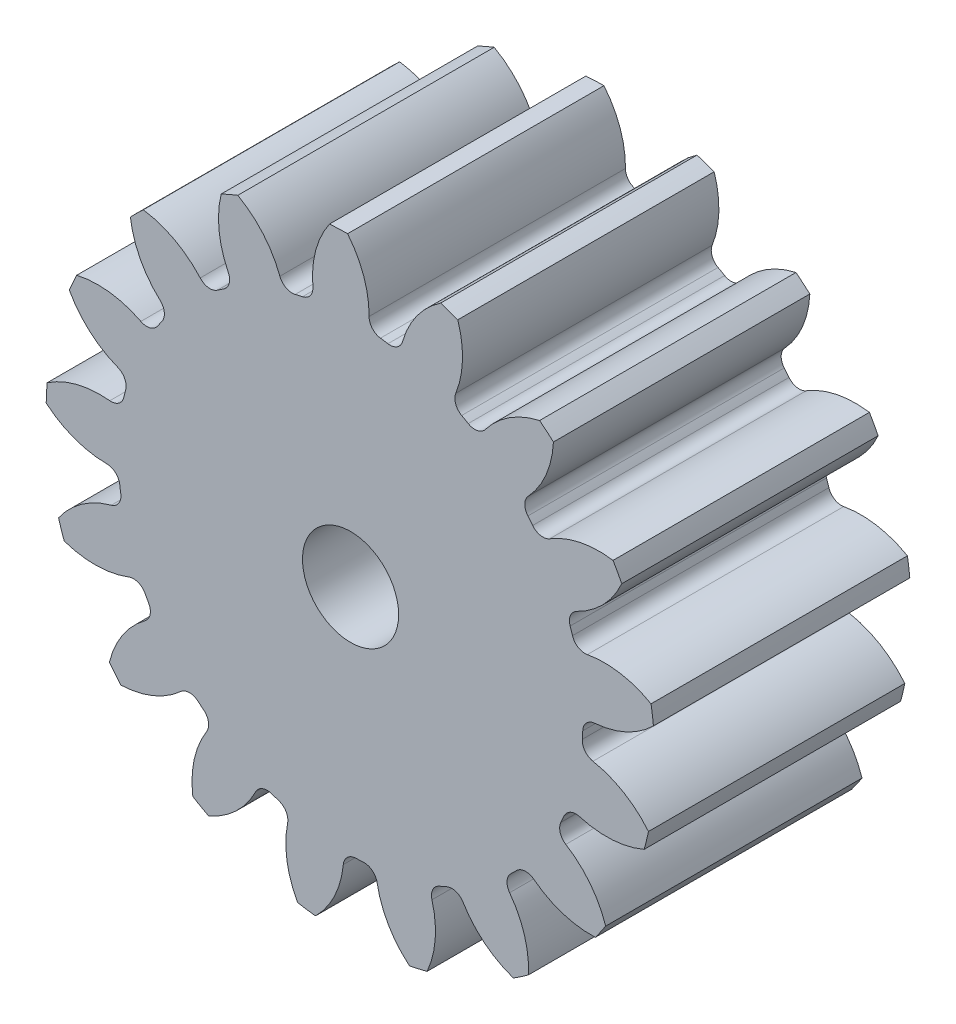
SolidWorks part; units mm, degrees
ref_plane "Front" through (0, 0, 0) normal (0, 0, 1) x (1, 0, 0)
ref_plane "Top" through (0, 0, 0) normal (0, 1, 0) x (1, 0, 0)
ref_plane "Right" through (0, 0, 0) normal (1, 0, 0) x (0, 0, -1)
sketch "Sketch3" plane through (0, 0, 0) normal (0, 0, 1) x (1, 0, 0)
  circle A0 centre (0, 0) radius 120.65
  dimension "od" = 241.3
extrude "gearBody" add sketch "Sketch3" along normal blind 101.6
sketch "Sketch2" plane through (0, 0, 0) normal (0, 0, 1) x (1, 0, 0)
  line L0 (0, 0) -> (93.7182, 38.8193) construction
  line L1 (118.6108, -25.6015) -> (0, 0) construction
  line L2 (0, 0) -> (36.3143, 0) construction
  line L3 (107.8661, 4.255) -> (106.8151, -15.6122) construction
  line L5 (107.3406, -5.6786) -> (0, 0) construction
  line L7 (0, 0) -> (101.4398, 0) construction
  arc A0 (101.4143, 2.2731) -> (100.6084, -12.9606) centre (0, 0) ccw construction
  arc A1 (120.0209, 12.3047) -> (118.0527, -24.8994) centre (0, 0) ccw construction
  arc A2 (107.8661, 4.255) -> (106.8151, -15.6122) centre (0, 0) ccw construction
  arc A3 (91.8551, -6.3599) -> (92.0134, -3.3672) centre (0, 0) ccw
  arc A4 (118.6108, -25.6015) -> (96.0497, -11.7955) centre (89.0992, -48.4908) ccw
  arc A5 (118.6108, -25.6015) -> (120.65, 12.944) centre (0, 0) ccw
  arc A6 (120.65, 12.944) -> (96.7581, 1.5955) centre (93.7182, 38.8193) cw
  arc A7 (92.0134, -3.3672) -> (96.7581, 1.5955) centre (97.1789, -3.5563) cw
  arc A8 (96.0497, -11.7955) -> (91.8551, -6.3599) centre (97.0116, -6.7169) cw
  point P6 (120.65, 12.944)
  point P22 (118.6108, -25.6015)
  dimension "baseDia" = 202.8796
  dimension "od" = 241.3
  dimension "pd" = 215.9
  dimension "rd" = 184.15
  dimension "rFillet" = 5.1689
  dimension "pointX" = 120.65
  dimension "pointY" = 12.944
  dimension "CTT" = 19.8672
  dimension "flankCenterAngle" = 22.5
extrude "toothCut" cut sketch "Sketch2" along normal through all
pattern_circular "CirPattern1" count 17 over 360 about axis through (0, 0, 0) along (0, 0, 1) of "toothCut"
sketch "hub1Dia" plane through (0, 0, 0) normal (0, 0, -1) x (-1, 0, 0)
  circle A0 centre (0, 0) radius 12.7
  dimension "hub1Dia" = 25.4
sketch "hub2Dia" plane through (0, 0, 101.6) normal (0, 0, 1) x (1, 0, 0)
  circle A0 centre (0, 0) radius 12.7
  dimension "hub2dia" = 25.4
sketch "boreDia" plane through (0, 0, 0) normal (0, 0, 1) x (1, 0, 0)
  circle A0 centre (0, 0) radius 19.05
  dimension "boreDia" = 38.1
extrude "bore" cut sketch "boreDia" against normal mid plane 25400
